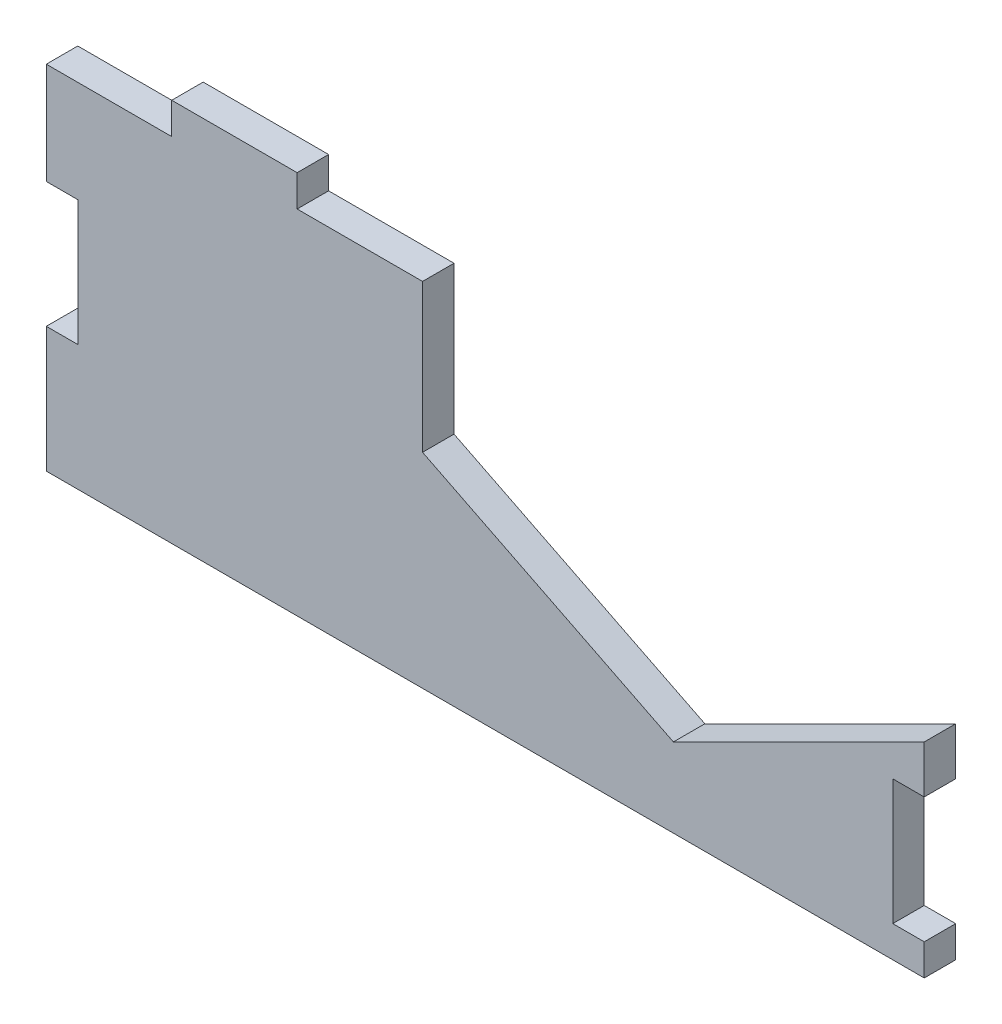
SolidWorks part; units mm, degrees
ref_plane "Front Plane" through (0, 0, 0) normal (0, 0, 1) x (1, 0, 0)
ref_plane "Top Plane" through (0, 0, 0) normal (0, 1, 0) x (1, 0, 0)
ref_plane "Right Plane" through (0, 0, 0) normal (1, 0, 0) x (0, 0, -1)
sketch "Sketch1" plane through (0, 0, 0) normal (0, 0, 1) x (1, 0, 0)
  line L2 (89.0643, 353.1343) -> (-62.3642, 277.42)
  line L3 (-440.9357, 381.1486) -> (-421.9357, 381.1486)
  line L7 (70.0643, 324.3628) -> (89.0643, 324.3628)
  line L11 (-440.9357, 442.4771) -> (-440.9357, 381.1486)
  line L12 (-440.9357, 229.72) -> (89.0643, 229.72)
  line L13 (-365.2214, 461.4771) -> (-365.2214, 442.4771)
  line L20 (-421.9357, 381.1486) -> (-421.9357, 305.4343)
  line L24 (-289.5071, 442.4771) -> (-213.7928, 442.4771)
  line L30 (89.0643, 353.1343) -> (89.0643, 324.3628)
  line L32 (70.0643, 324.3628) -> (70.0643, 248.6486)
  line L37 (70.0643, 248.6486) -> (89.0643, 248.6486)
  line L38 (-213.7928, 442.4771) -> (-213.7928, 353.1343)
  line L39 (-440.9357, 305.4343) -> (-440.9357, 229.72)
  line L40 (-213.7928, 353.1343) -> (-62.3642, 277.42)
  line L41 (89.0643, 248.6486) -> (89.0643, 229.72)
  line L42 (-440.9357, 305.4343) -> (-421.9357, 305.4343)
  line L43 (-365.2214, 461.4771) -> (-289.5071, 461.4771)
  line L44 (-289.5071, 461.4771) -> (-289.5071, 442.4771)
  line L46 (-440.9357, 442.4771) -> (-365.2214, 442.4771)
  dimension "D1" = 19
  dimension "D2" = 530
extrude "Boss-Extrude1" add sketch "Sketch1" along normal blind 19
